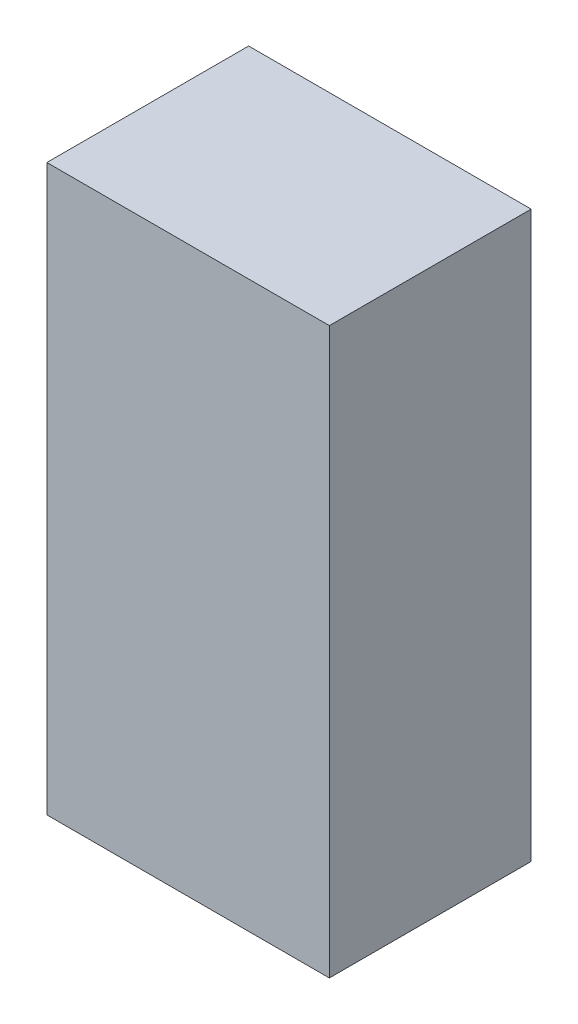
SolidWorks part; units mm, degrees
ref_plane "Front Plane" through (0, 0, 0) normal (0, 0, 1) x (1, 0, 0)
ref_plane "Top Plane" through (0, 0, 0) normal (0, 1, 0) x (1, 0, 0)
ref_plane "Right Plane" through (0, 0, 0) normal (1, 0, 0) x (0, 0, -1)
sketch "Sketch1" plane through (0, 0, 0) normal (0, 0, 1) x (1, 0, 0)
  line L0 (-8.89, 17.78) -> (8.89, -17.78) construction
  line L1 (-8.89, 17.78) -> (8.89, 17.78)
  line L2 (-8.89, 17.78) -> (-8.89, -17.78)
  line L3 (-8.89, -17.78) -> (8.89, -17.78)
  line L4 (8.89, 17.78) -> (8.89, -17.78)
  dimension "D1" = 17.78
  dimension "D2" = 35.56
extrude "Boss-Extrude2" add sketch "Sketch1" along normal blind 12.7
